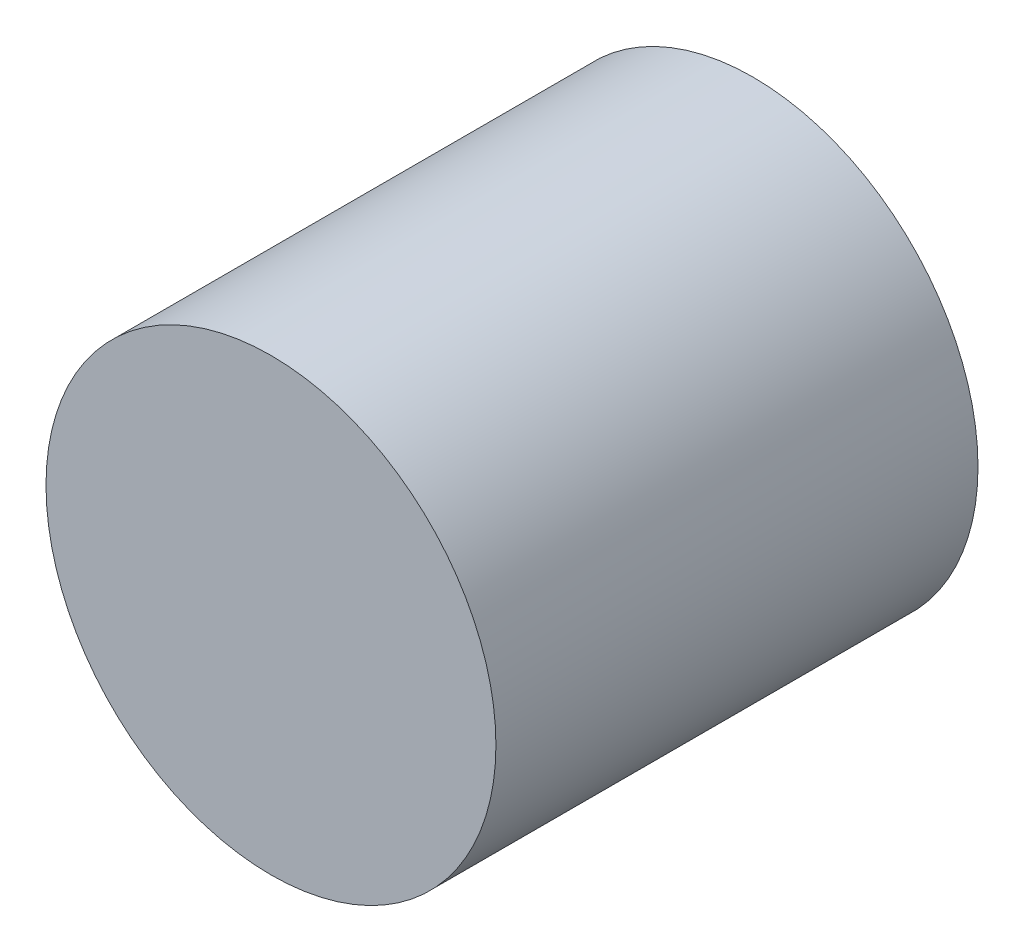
SolidWorks part; units mm, degrees
ref_plane "Płaszczyzna przednia" through (0, 0, 0) normal (0, 0, 1) x (1, 0, 0)
ref_plane "Płaszczyzna górna" through (0, 0, 0) normal (0, 1, 0) x (1, 0, 0)
ref_plane "Płaszczyzna prawa" through (0, 0, 0) normal (1, 0, 0) x (0, 0, -1)
sketch "Szkic1" plane through (0, 0, 0) normal (0, 0, 1) x (1, 0, 0)
  circle A0 centre (0, 0) radius 70
  dimension "D1" = 140
extrude "Dodanie-wyciągnięcie1" add sketch "Szkic1" along normal blind 150
